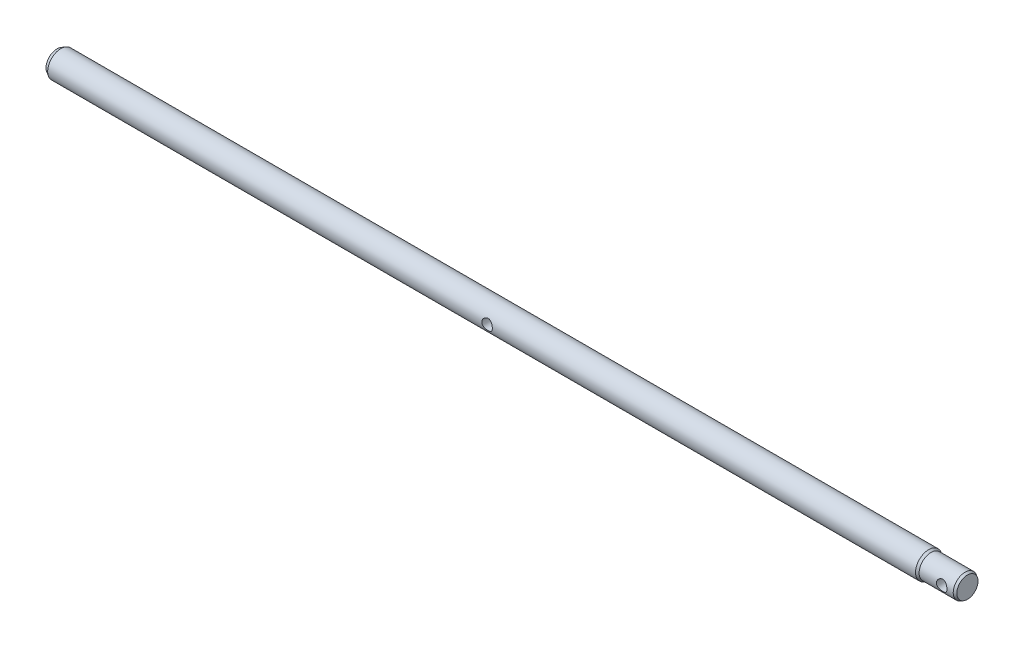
SolidWorks part; units mm, degrees
ref_plane "Plan1" through (0, 0, 0) normal (0, 0, 1) x (1, 0, 0)
ref_plane "Plan2" through (0, 0, 0) normal (0, 1, 0) x (1, 0, 0)
ref_plane "Plan3" through (0, 0, 0) normal (1, 0, 0) x (0, 0, -1)
sketch "Esquisse1" plane through (0, 0, 0) normal (0, 0, 1) x (1, 0, 0)
  line L0 (-98, 0) -> (129, 0) construction
  line L1 (-142, 0) -> (-142, 10)
  line L2 (-142, 10) -> (518.5, 10)
  line L3 (518.5, 10) -> (518.5, 9)
  line L4 (518.5, 9) -> (546, 9)
  line L5 (546, 9) -> (546, 0)
  line L6 (546, 0) -> (-142, 0)
  dimension "D1" = 688
  dimension "D2" = 27.5
  dimension "D3" = 10
  dimension "D4" = 9
revolve "Base-Révolution" add sketch "Esquisse1" angle 360 about L0
chamfer "Chanfrein1" distance 1 angle 60
chamfer "Chanfrein2" distance 1 angle 60
chamfer "Chanfrein3" distance 3 angle 30
sketch "Esquisse2" plane through (0, 0, 0) normal (0, 0, 1) x (1, 0, 0)
  line L0 (544.2679, 0) -> (546, 0) construction
  line L1 (546, -8) -> (546, 8) construction
  circle A0 centre (535.5, 0) radius 4
  dimension "D1" = 8
  dimension "D2" = 10.5
extrude "Enlèv. mat.-Extru.1" cut sketch "Esquisse2" against normal mid plane 30
sketch "Esquisse3" plane through (0, 0, 0) normal (0, 0, 1) x (1, 0, 0)
  line L0 (544.2679, 0) -> (546, 0) construction
  line L1 (-142, 8.2679) -> (-142, -8.2679) construction
  circle A0 centre (193, 0) radius 4
  dimension "D1" = 8
  dimension "D2" = 335
extrude "Enlèv. mat.-Extru.2" cut sketch "Esquisse3" against normal mid plane 30
